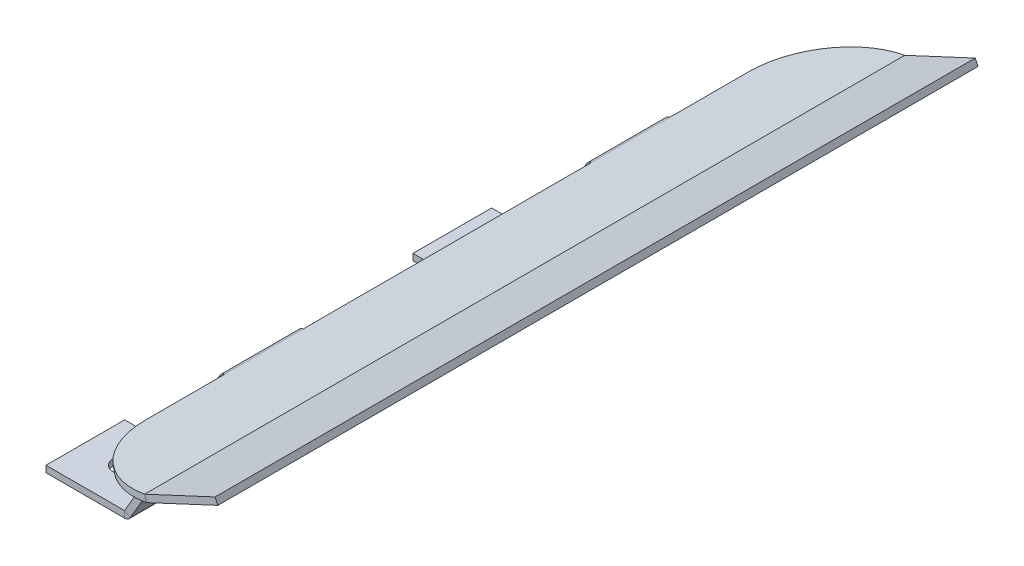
SolidWorks part; units mm, degrees
ref_plane "Front Plane" through (0, 0, 0) normal (0, 0, 1) x (1, 0, 0)
ref_plane "Top Plane" through (0, 0, 0) normal (0, 1, 0) x (1, 0, 0)
ref_plane "Right Plane" through (0, 0, 0) normal (1, 0, 0) x (0, 0, -1)
sketch "Sketch1" plane through (0, 0, 0) normal (0, 1, 0) x (1, 0, 0)
  line L0 (0, 0) -> (24, 0) construction
  line L1 (12, 58) -> (24, 58)
  line L2 (24, 58) -> (24, -58)
  line L3 (0, 46) -> (0, 34)
  line L4 (0, 34) -> (-42, 34)
  line L5 (-42, 34) -> (-42, 22)
  line L6 (-42, 22) -> (0, 22)
  line L7 (0, 22) -> (0, -22)
  line L8 (-42, 28) -> (-36, 28) construction
  line L9 (-42, -22) -> (0, -22)
  line L10 (-42, -34) -> (-42, -22)
  line L11 (0, -34) -> (-42, -34)
  line L12 (0, -46) -> (0, -34)
  line L13 (12, -58) -> (24, -58)
  arc A0 (12, 58) -> (0, 46) centre (12, 46) ccw
  circle A1 centre (-36, 28) radius 1.75
  circle A2 centre (-36, -28) radius 1.75
  arc A3 (12, -58) -> (0, -46) centre (12, -46) cw
  dimension "D3" = 24
  dimension "D9" = 3.5
  dimension "D1" = 58
  dimension "D2" = 12
  dimension "D4" = 12
  dimension "D5" = 12
  dimension "D6" = 24
  dimension "D7" = 42
  dimension "D8" = 6
  dimension "D10" = 22
sheet metal parameters "Sheet-Metal1" thickness 1 parameters "D1"=0.7366
base flange "Base-Flange1" sketch "Sketch1" thickness 1 reverse thickness direction no parameters "D1"=0.7366
sketch "Sketch3" plane through (0, 0, 0) normal (0, 1, 0) x (1, 0, 0)
  line L0 (12, 58) -> (12, -58)
sketched bend "Sketched Bend1" parameters "D1"=0.001
bend "SketchBend1" bend radius 0.001 bend angle 15 parameters "D5"=1
sketch "Sketch4" plane through (0, 0, 0) normal (0, 1, 0) x (1, 0, 0)
  line L0 (-30, 34) -> (-30, -34)
  line L1 (0, 34) -> (-42, 34) construction
  line L2 (-42, -34) -> (0, -34) construction
  line L3 (-42, 34) -> (-42, 22) construction
  dimension "D1" = 12
sketched bend "Sketched Bend2" parameters "D1"=0.001
bend "SketchBend2" bend radius 0.001 bend angle 60 parameters "D5"=2
sketch "Sketch5" plane through (-22.4996, 12.9901, 0) normal (-0.866, 0.5, 0) x (0, 0, 1)
  line L0 (-34, 14.4762) -> (34, 14.4762)
sketched bend "Sketched Bend3" parameters "D1"=0.001
bend "SketchBend3" bend radius 0.001 bend angle 50 parameters "D5"=3
flat pattern "Flat-Pattern1"
sketch "Bend-Lines1" plane through (-10.7137, 22.9755, 0) normal (0.4226, -0.9063, 0) x (0.9063, 0.4226, 0)
  line L0 (-3.352, 34) -> (-3.352, -34) construction
  line L1 (-32.8415, 34) -> (-32.8415, -34) construction
  line L2 (8.9618, 58) -> (8.9618, -58) construction
sketch3d "Bounding-Box1" [suppressed]
  line L0 (-54, -12, 0) -> (-54, 104, 0) construction
  line L1 (12, -12, 0) -> (12, 104, 0) construction
  line L2 (-54, -12, 0) -> (12, -12, 0) construction
  line L3 (-54, 104, 0) -> (12, 104, 0) construction
